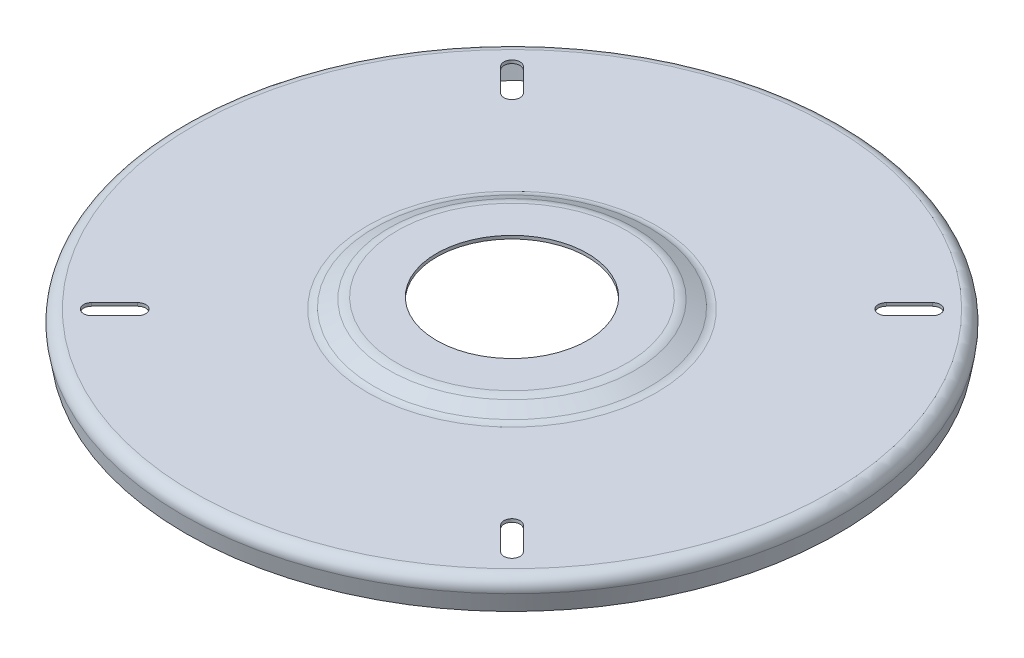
SolidWorks part; units mm, degrees
ref_plane "Plan de face" through (0, 0, 0) normal (0, 0, 1) x (1, 0, 0)
ref_plane "Plan de dessus" through (0, 0, 0) normal (0, 1, 0) x (1, 0, 0)
ref_plane "Plan de droite" through (0, 0, 0) normal (1, 0, 0) x (0, 0, -1)
sketch "Esquisse1" plane through (0, 0, 0) normal (0, 0, 1) x (1, 0, 0)
  line L0 (0, 36.5209) -> (-108.8444, 36.5209)
  line L1 (-115.4199, 35.0029) -> (-129.0754, 28.3426)
  line L2 (-136.9661, 26.5209) -> (-301.277, 26.5209)
  line L3 (-309.1556, 17.1316) -> (-306.2267, 0.5209)
  line L4 (0, 39.5209) -> (-108.8444, 39.5209)
  line L5 (-116.7351, 37.6992) -> (-130.3905, 31.039)
  line L6 (-136.9661, 29.5209) -> (-301.277, 29.5209)
  line L7 (-312.11, 16.6107) -> (-309.1811, 0)
  line L8 (0, -1.5849) -> (0, 41.5149) construction
  line L9 (-306.2267, 0.5209) -> (-309.1811, 0)
  line L10 (0, 39.5209) -> (0, 36.5209)
  arc A0 (-108.8444, 39.5209) -> (-116.7351, 37.6992) centre (-108.8444, 21.5209) ccw
  arc A1 (-136.9661, 29.5209) -> (-130.3905, 31.039) centre (-136.9661, 44.5209) ccw
  arc A4 (-301.277, 29.5209) -> (-312.11, 16.6107) centre (-301.277, 18.5208) ccw
  arc A6 (-108.8444, 36.5209) -> (-115.4199, 35.0029) centre (-108.8444, 21.5209) ccw
  arc A7 (-136.9661, 26.5209) -> (-129.0754, 28.3426) centre (-136.9661, 44.5209) ccw
  arc A8 (-301.277, 26.5209) -> (-309.1556, 17.1316) centre (-301.277, 18.5208) ccw
  point P1 (0, 39.5209)
  point P23 (0, 39.5209)
  dimension "D2" = 18
  dimension "D3" = 15
  dimension "D1" = 108.8444
  dimension "D4" = 301.277
  dimension "D5" = 624.22
  dimension "D6" = 130.3905
  dimension "D7" = 39.5209
  dimension "D8" = 80
  dimension "D9" = 3
  dimension "D10" = 29.5209
  dimension "D14" = 154
revolve "Révolution1" add sketch "Esquisse1" angle 360 about L8
sketch "Esquisse2" plane through (0, 39.5209, 0) normal (0, 1, 0) x (1, 0, 0)
  circle A0 centre (0, 0) radius 71.5
  dimension "D1" = 143
extrude "Extrusion1" cut sketch "Esquisse2" against normal up to next
sketch "Esquisse3" plane through (0, 29.5209, 0) normal (0, 1, 0) x (1, 0, 0)
  line L0 (171.9542, -182.7023) -> (193.7473, -204.4953)
  line L1 (204.4953, -193.7473) -> (182.7023, -171.9542)
  line L2 (0, 0) -> (213.035, -213.035) construction
  line L3 (0, 0) -> (312.2771, 0) construction
  arc A0 (182.7023, -171.9542) -> (171.9542, -182.7023) centre (177.3282, -177.3282) ccw
  arc A1 (193.7473, -204.4953) -> (204.4953, -193.7473) centre (199.1213, -199.1213) ccw
  circle A2 centre (0, 0) radius 301.277 construction
  circle A3 centre (0, 0) radius 312.2771 construction
  dimension "D2" = 15.2
  dimension "D1" = 250.78
  dimension "D3" = 30.82
  dimension "D4" = 45
extrude "Extrusion2" cut sketch "Esquisse3" against normal up to next
pattern_circular "Répétition circulaire1" count 4 over 360 about axis through (0, 0, 0) along (0, 1, 0) of "Extrusion2"
